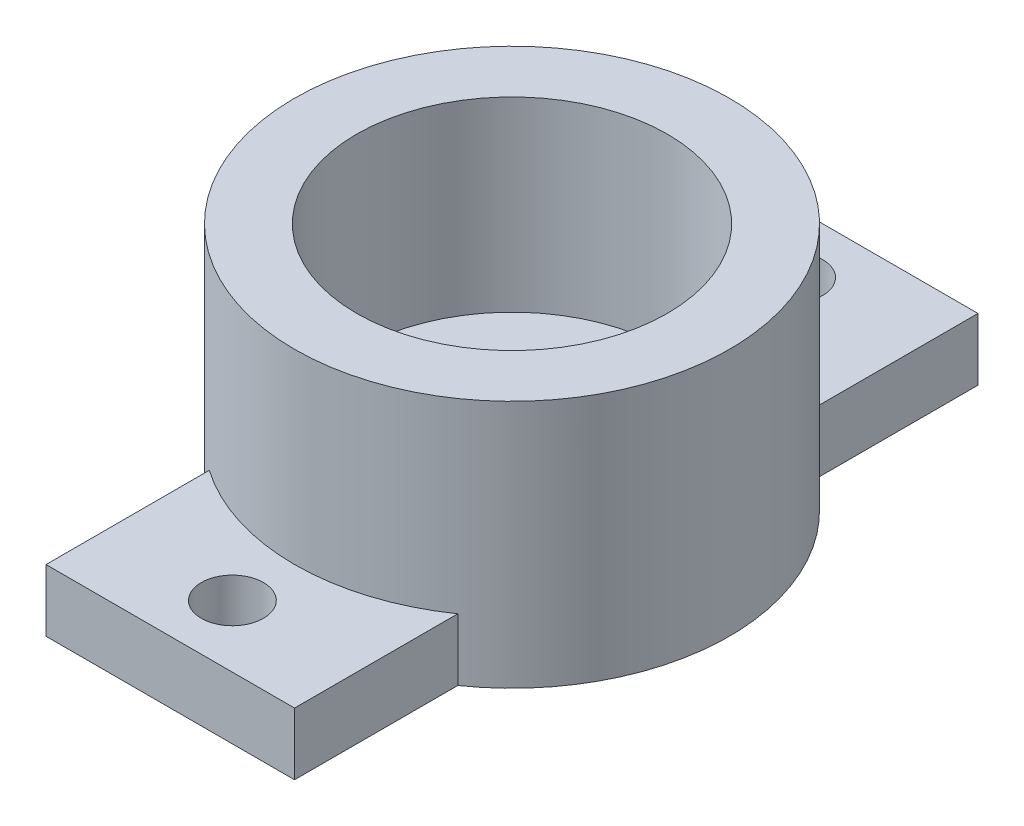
SolidWorks part; units mm, degrees
ref_plane "Front Plane" through (0, 0, 0) normal (0, 0, 1) x (1, 0, 0)
ref_plane "Top Plane" through (0, 0, 0) normal (0, 1, 0) x (1, 0, 0)
ref_plane "Right Plane" through (0, 0, 0) normal (1, 0, 0) x (0, 0, -1)
sketch "Sketch1" plane through (0, 0, 0) normal (0, 1, 0) x (1, 0, 0)
  circle A0 centre (0, 0) radius 3.5
  circle A1 centre (0, 0) radius 2.5
  dimension "D1" = 1
  dimension "D2" = 7
extrude "Boss-Extrude1" add sketch "Sketch1" along normal blind 4
sketch "Sketch2" plane through (0, 0, 0) normal (0, 1, 0) x (1, 0, 0)
  line L0 (-2, 2.8723) -> (-2, 6.5)
  line L1 (2, 6.5) -> (2, 2.8723)
  line L2 (-3.5, 0) -> (3.5, 0) construction
  line L3 (2, -6.5) -> (2, -2.8723)
  line L4 (-2, -2.8723) -> (-2, -6.5)
  circle A0 centre (0, 0) radius 3.5 construction
  arc A1 (-2, 6.5) -> (2, 6.5) centre (0, 6.5) cw
  arc A2 (-2, -6.5) -> (2, -6.5) centre (0, -6.5) ccw
  circle A3 centre (0, 0) radius 2.5 construction
  circle A4 centre (0, 0) radius 2.5
  arc A5 (-2, -2.8723) -> (2, -2.8723) centre (0, 0) ccw
  arc A6 (2, 2.8723) -> (-2, 2.8723) centre (0, 0) ccw
  point P16 (0, 8.5)
  point P17 (0, -8.5)
  dimension "D1" = 2
  dimension "D2" = 17
extrude "Boss-Extrude2" add sketch "Sketch2" along normal blind 1
sketch "Sketch3" plane through (0, 1, 0) normal (0, 1, 0) x (1, 0, 0)
  line L0 (-3.5, 0) -> (3.5, 0) construction
  circle A0 centre (0, 6.5) radius 0.5
  circle A1 centre (0, 4.5) radius 0.5
  circle A2 centre (0, 0) radius 3.5 construction
  circle A3 centre (0, -4.5) radius 0.5
  circle A4 centre (0, -6.5) radius 0.5
  dimension "D1" = 1
  dimension "D2" = 2
extrude "Cut-Extrude1" cut sketch "Sketch3" against normal through all
sketch "Sketch4" plane through (0, 1, 0) normal (0, 1, 0) x (1, 0, 0)
  line L0 (-2, 5.5) -> (2, 5.5)
  line L1 (-2, 6.5) -> (-2, 2.8723) construction
  line L2 (2, 2.8723) -> (2, 6.5) construction
  line L3 (2, 5.5) -> (2, 6.5)
  line L4 (-2, 6.5) -> (-2, 5.5)
  line L5 (-2.5, 0) -> (2.5, 0) construction
  line L6 (-2, -6.5) -> (-2, -5.5)
  line L7 (2, -5.5) -> (2, -6.5)
  line L8 (-2, -5.5) -> (2, -5.5)
  circle A2 centre (0, 4.5) radius 0.5 construction
  arc A3 (2, 6.5) -> (-2, 6.5) centre (0, 6.5) ccw construction
  arc A4 (2, 6.5) -> (-2, 6.5) centre (0, 6.5) ccw
  circle A5 centre (0, 0) radius 2.5 construction
  circle A6 centre (0, 0) radius 2.5 construction
  arc A7 (2, -6.5) -> (-2, -6.5) centre (0, -6.5) cw
  dimension "D1" = 0.5
extrude "Cut-Extrude2" cut sketch "Sketch4" against normal blind 10
